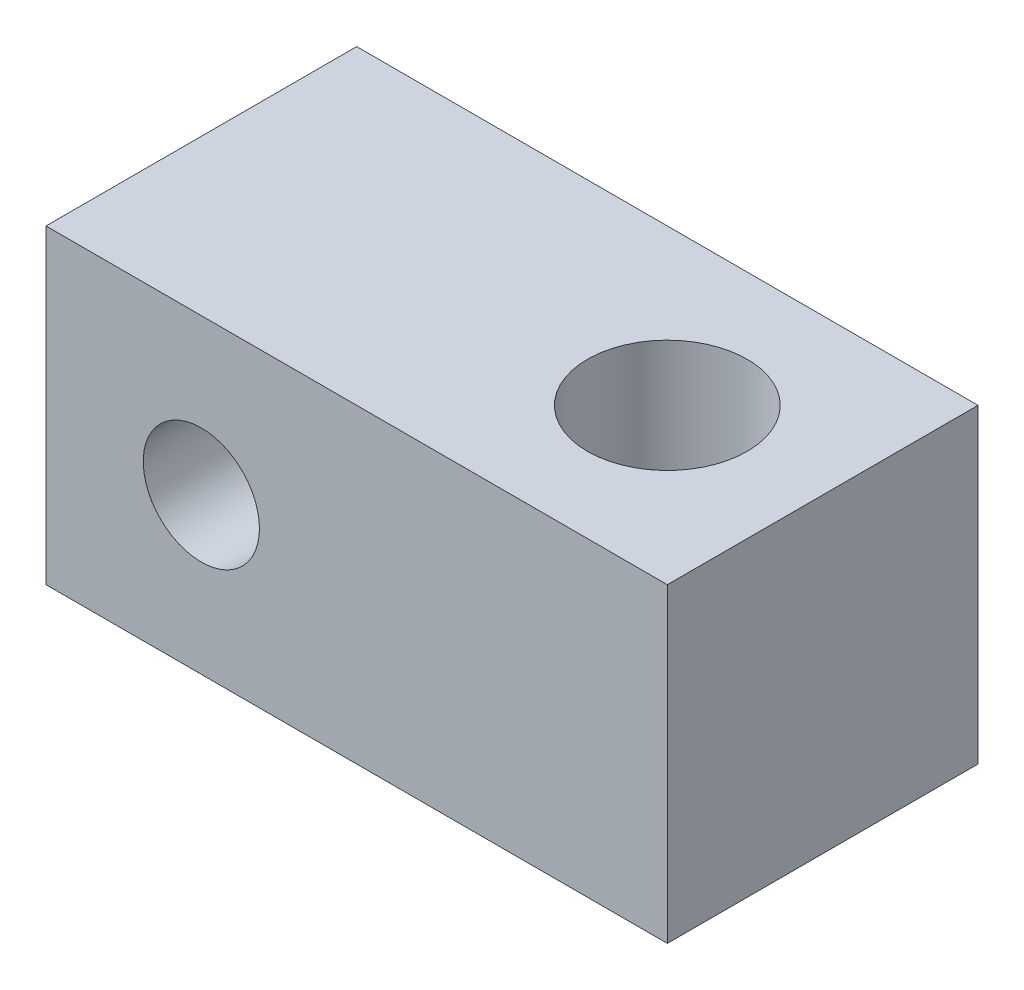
SolidWorks part; units mm, degrees
ref_plane "Front Plane" through (0, 0, 0) normal (0, 0, 1) x (1, 0, 0)
ref_plane "Top Plane" through (0, 0, 0) normal (0, 1, 0) x (1, 0, 0)
ref_plane "Right Plane" through (0, 0, 0) normal (1, 0, 0) x (0, 0, -1)
sketch "Sketch1" plane through (0, 0, 0) normal (0, 0, 1) x (1, 0, 0)
  line L1 (0, 0) -> (12.7, 0)
  line L2 (0, 0) -> (0, -6.35)
  line L3 (0, -6.35) -> (12.7, -6.35)
  line L4 (12.7, 0) -> (12.7, -6.35)
  dimension "D1" = 12.7
  dimension "D2" = 6.35
extrude "Extrude2" add sketch "Sketch1" along normal blind 6.35
hole_wizard "Tap Drill for #4-48 Tap1" positions "3DSketch1" profile "Sketch3" hole size "#4-48" standard "Ansi Inch"
sketch3d "3DSketch1"
  line L0 (0, -6.35, 6.35) -> (12.7, -6.35, 6.35) construction
  line L1 (0, 0, 6.35) -> (0, -6.35, 6.35) construction
  point P0 (3.175, -3.175, 6.35)
  dimension "D1" = 3.175
  dimension "D2" = 3.175
sketch "Sketch3" plane through (3.175, -3.175, 6.35) normal (1, 0, 0) x (0, -1, 0)
  line L0 (0, 0) -> (0, 6.35)
  line L1 (0, 6.35) -> (1.1874, 6.35)
  line L2 (1.1874, 6.35) -> (1.1874, 0)
  line L5 (1.1874, 0) -> (0, 0)
  line L11 (0, -6.35) -> (0, 107.95) construction
  dimension "Thru Hole Dia." = 2.3749
  dimension "Thru Hole Depth" = 6.35
hole_wizard "#4 Clearance Hole1" positions "3DSketch2" profile "Sketch5" hole size "#4" standard "Ansi Inch"
sketch3d "3DSketch2"
  line L0 (12.7, 0, 6.35) -> (0, 0, 6.35) construction
  line L1 (12.7, 0, 6.35) -> (12.7, 0, 0) construction
  point P1 (9.525, 0, 3.175)
  dimension "D1" = 3.175
  dimension "D2" = 3.175
sketch "Sketch5" plane through (9.525, 0, 3.175) normal (1, 0, 0) x (0, 0, 1)
  line L0 (0, 0) -> (0, 6.35)
  line L1 (0, 6.35) -> (1.6319, 6.35)
  line L2 (1.6319, 6.35) -> (1.6319, 0)
  line L5 (1.6319, 0) -> (0, 0)
  line L11 (0, -6.35) -> (0, 107.95) construction
  dimension "Thru Hole Dia." = 3.2639
  dimension "Thru Hole Depth" = 6.35
